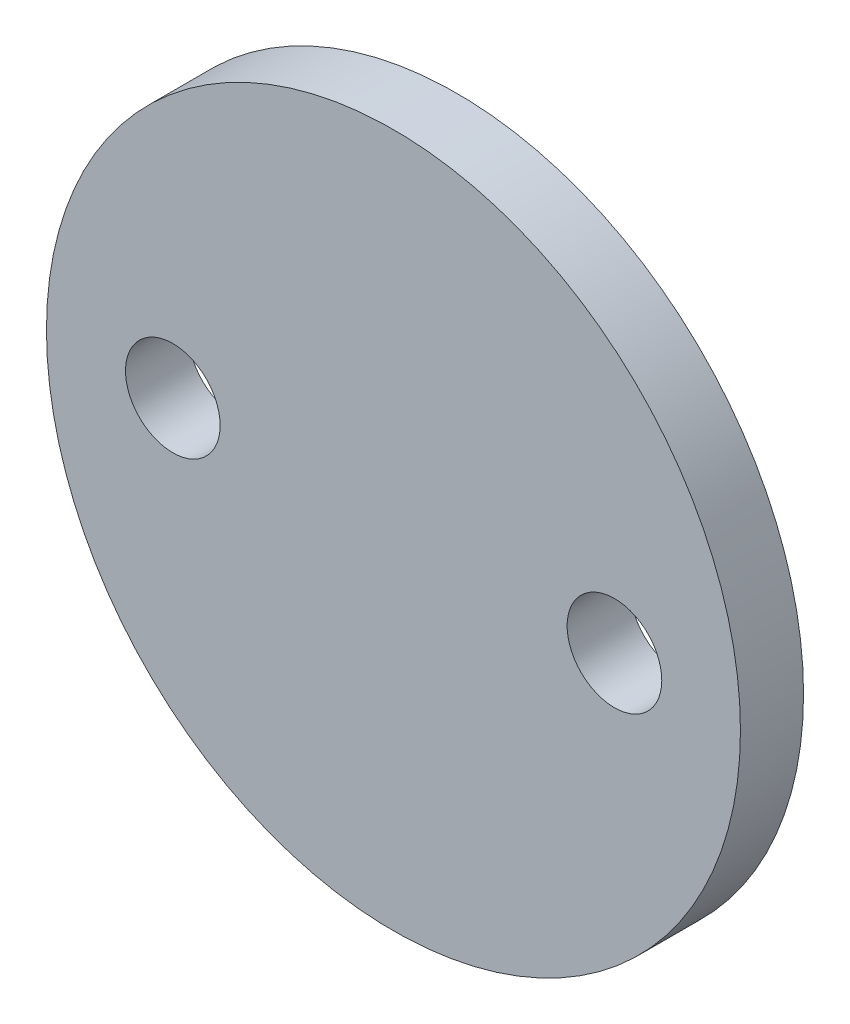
SolidWorks part; units mm, degrees
ref_plane "Front Plane" through (0, 0, 0) normal (0, 0, 1) x (1, 0, 0)
ref_plane "Top Plane" through (0, 0, 0) normal (0, 1, 0) x (1, 0, 0)
ref_plane "Right Plane" through (0, 0, 0) normal (1, 0, 0) x (0, 0, -1)
inserted part "NoseBulkPlateBottom"
other "<NoseBulkPlateBottom>-<Cut-Extrude1>"
sketch "Sketch2" plane through (0, 0, 10.9997) normal (0, 0, 1) x (1, 0, 0)
  circle A0 centre (-21.9428, 14.3694) radius 2.3813
  circle A1 centre (-21.9428, 14.3694) radius 2.4447
  dimension "D1" = 4.7625
extrude "Extrude2" add sketch "Sketch2" against normal up to surface (3.175 mm away)
sketch "Sketch3" plane through (0, 0, 10.9997) normal (0, 0, 1) x (1, 0, 0)
  circle A0 centre (-44.1678, 14.3694) radius 2.3812
  circle A1 centre (-44.1678, 14.3694) radius 2.4447
  dimension "D1" = 4.7625
extrude "Extrude3" add sketch "Sketch3" against normal up to surface (3.175 mm away)
